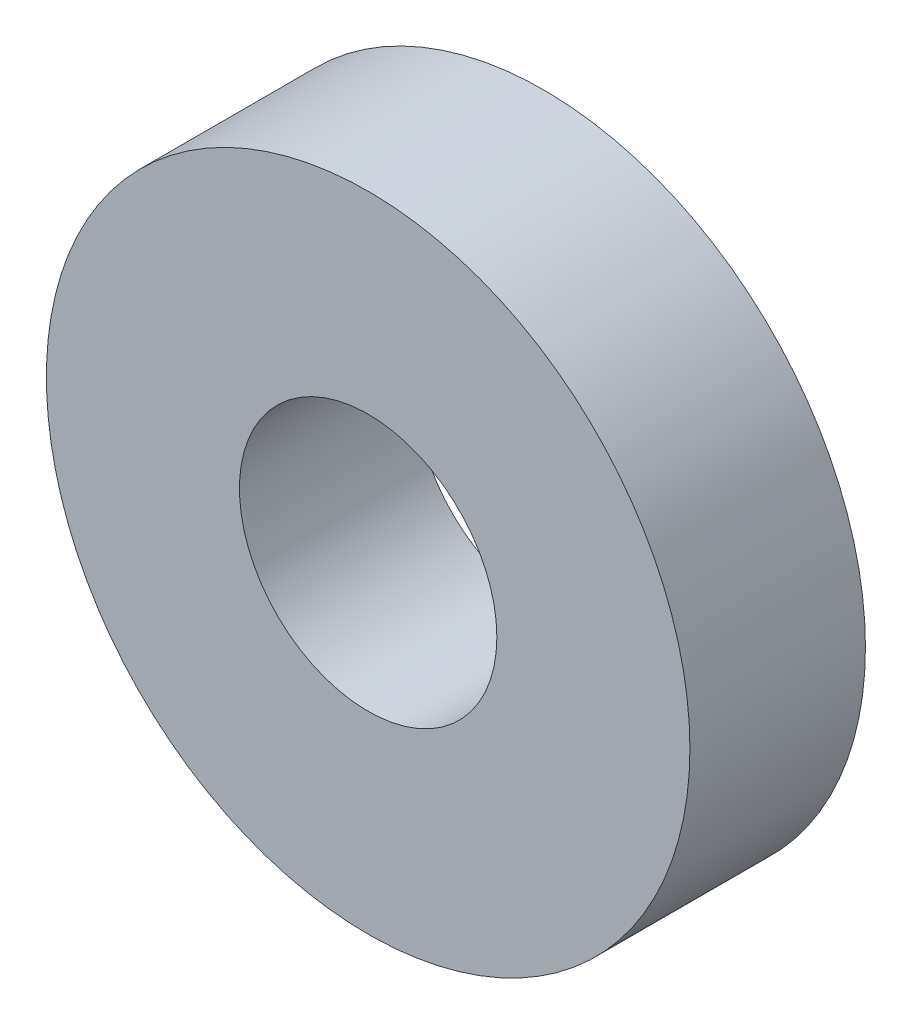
SolidWorks part; units mm, degrees
ref_plane "Plan de face" through (0, 0, 0) normal (0, 0, 1) x (1, 0, 0)
ref_plane "Plan de dessus" through (0, 0, 0) normal (0, 1, 0) x (1, 0, 0)
ref_plane "Plan de droite" through (0, 0, 0) normal (1, 0, 0) x (0, 0, -1)
sketch "Esquisse1" plane through (0, 0, 0) normal (0, 0, 1) x (1, 0, 0)
  circle A0 centre (0, -2) radius 2.75
  circle A1 centre (0, -2) radius 1.1
extrude "Extrusion1" add sketch "Esquisse1" along normal blind 1.5
